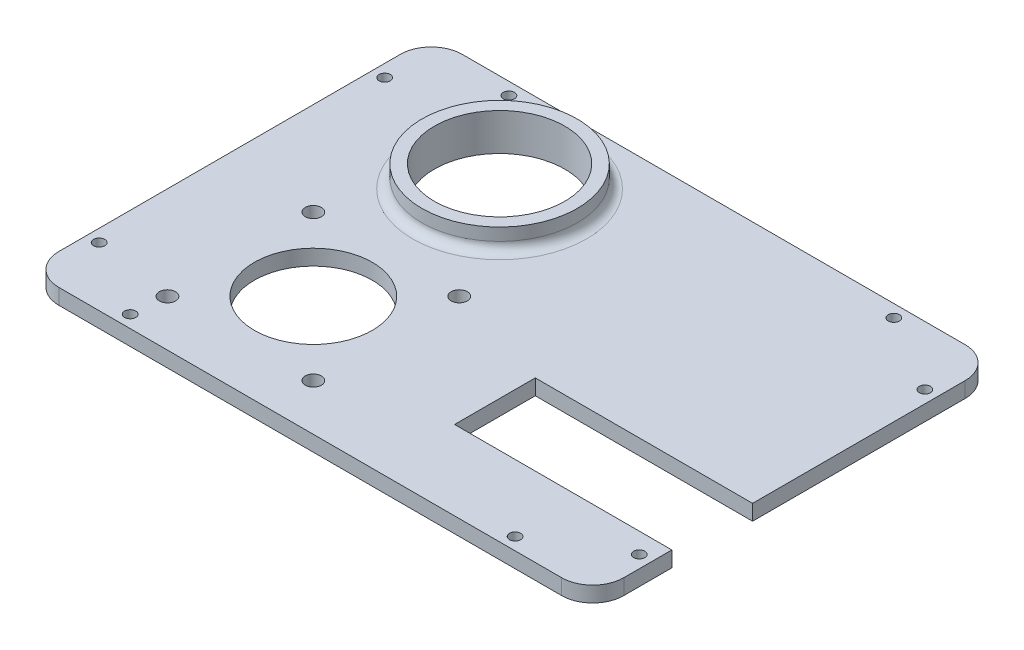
SolidWorks part; units mm, degrees
ref_plane "Front Plane" through (0, 0, 0) normal (0, 0, 1) x (1, 0, 0)
ref_plane "Top Plane" through (0, 0, 0) normal (0, 1, 0) x (1, 0, 0)
ref_plane "Right Plane" through (0, 0, 0) normal (1, 0, 0) x (0, 0, -1)
sketch "Sketch1" plane through (0, 0, 0) normal (0, 1, 0) x (1, 0, 0)
  line L20 (-28.5, 28.5) -> (28.5, 28.5)
  line L21 (-28.5, 28.5) -> (-28.5, -28.5)
  line L22 (-28.5, -28.5) -> (28.5, -28.5)
  line L23 (28.5, 28.5) -> (28.5, -28.5)
  line L24 (-28.5, 28.5) -> (28.5, -28.5) construction
  line L25 (-28.5, -28.5) -> (28.5, 28.5) construction
  line L26 (128.5, 13) -> (58.5, 13)
  line L27 (-43.5, 91.5) -> (118.5, 91.5)
  line L28 (-53.5, 81.5) -> (-53.5, -28.5)
  line L29 (-43.5, -38.5) -> (118.5, -38.5)
  line L30 (128.5, 81.5) -> (128.5, -28.5)
  line L31 (58.5, 13) -> (58.5, -13)
  line L32 (58.5, -13) -> (128.5, -13)
  line L33 (-10.5931, 81) -> (7.4203, 81) construction
  circle A12 centre (-23.5, 23.5) radius 2.6
  circle A13 centre (23.5, 23.5) radius 2.6
  circle A14 centre (23.5, -23.5) radius 2.6
  circle A15 centre (-23.5, -23.5) radius 2.6
  circle A16 centre (0, 0) radius 19
  circle A17 centre (0, 60) radius 21
  arc A18 (-43.5, 91.5) -> (-53.5, 81.5) centre (-43.5, 81.5) ccw
  arc A19 (118.5, 91.5) -> (128.5, 81.5) centre (118.5, 81.5) cw
  arc A20 (118.5, -38.5) -> (128.5, -28.5) centre (118.5, -28.5) ccw
  arc A21 (-53.5, -28.5) -> (-43.5, -38.5) centre (-43.5, -28.5) ccw
  point P0 (0, 0)
  point P7 (58.5, 0)
  point P37 (0, 0)
  dimension "D3" = 5.2
  dimension "D4" = 5
  dimension "D5" = 5
  dimension "D6" = 5.2
  dimension "D7" = 5
  dimension "D8" = 5
  dimension "D9" = 5.2
  dimension "D12" = 5.2
  dimension "D13" = 5
  dimension "D14" = 5
  dimension "D19" = 38
  dimension "D22" = 42
  dimension "D23" = 10
  dimension "D1" = 57
  dimension "D2" = 57
  dimension "D10" = 5
  dimension "D11" = 5
  dimension "D15" = 53.5
  dimension "D16" = 130
  dimension "D17" = 10
  dimension "D18" = 100
  dimension "D20" = 26
  dimension "D21" = 70
  dimension "D24" = 60
extrude "Boss-Extrude1" add sketch "Sketch1" along normal blind 5 contours L30 L27 L28 L29 L20 L23 L22 L21 | L23 L20 L21 L22 A15 A14 A13 A12
sketch "Sketch2" plane through (0, 5, 0) normal (0, 1, 0) x (1, 0, 0)
  circle A0 centre (0, 60) radius 25
  circle A1 centre (0, 60) radius 21
  point P4 (0, 0)
  dimension "D1" = 50
  dimension "D2" = 42
extrude "Boss-Extrude2" add sketch "Sketch2" along normal blind 7
fillet "Fillet1" radius 3 1 edges at (0, 5, -35)
sketch "Sketch4" plane through (0, 5, 0) normal (0, 1, 0) x (1, 0, 0)
  line L0 (-53.5, 26.5) -> (-37.2936, 26.5) construction
  line L1 (37.5, -49.0845) -> (37.5, -28.0576) construction
  line L2 (-43.5, -38.5) -> (118.5, -38.5) construction
  line L3 (-53.5, 81.5) -> (-53.5, -28.5) construction
  circle A0 centre (-49.5, -19.5) radius 1.8
  circle A1 centre (-24.5, -34.5) radius 1.8
  circle A8 centre (-24.5, 87.5) radius 1.8
  circle A9 centre (-49.5, 72.5) radius 1.8
  circle A10 centre (99.5, -34.5) radius 1.8
  circle A11 centre (124.5, -19.5) radius 1.8
  circle A12 centre (124.5, 72.5) radius 1.8
  circle A13 centre (99.5, 87.5) radius 1.8
  point P8 (0, 0)
  point P9 (-53.5, 26.5)
  point P10 (0, 0)
  point P11 (37.5, -38.5)
  point P24 (-31.704, -34.6122)
  dimension "D1" = 3.6
  dimension "D2" = 3.6
  dimension "D5" = 4
  dimension "D3" = 19
  dimension "D4" = 4
  dimension "D6" = 29
extrude "Cut-Extrude1" cut sketch "Sketch4" against normal through all
